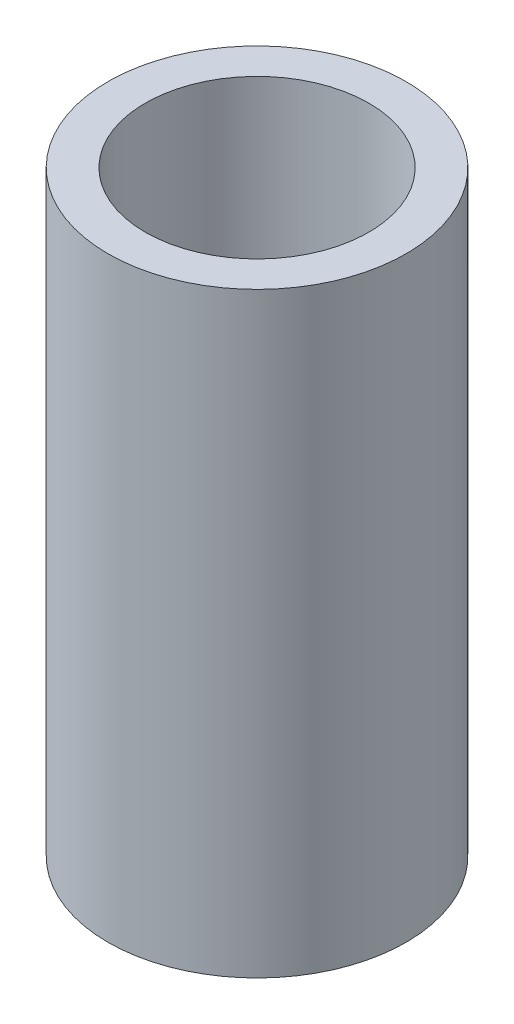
SolidWorks part; units mm, degrees
ref_plane "Front Plane" through (0, 0, 0) normal (0, 0, 1) x (1, 0, 0)
ref_plane "Top Plane" through (0, 0, 0) normal (0, 1, 0) x (1, 0, 0)
ref_plane "Right Plane" through (0, 0, 0) normal (1, 0, 0) x (0, 0, -1)
sketch "Sketch1" plane through (0, 0, 0) normal (0, 1, 0) x (1, 0, 0)
  circle A0 centre (0, 0) radius 4
  circle A1 centre (0, 0) radius 3
  dimension "D1" = 8
  dimension "D2" = 6
extrude "Boss-Extrude1" add sketch "Sketch1" along normal blind 16
